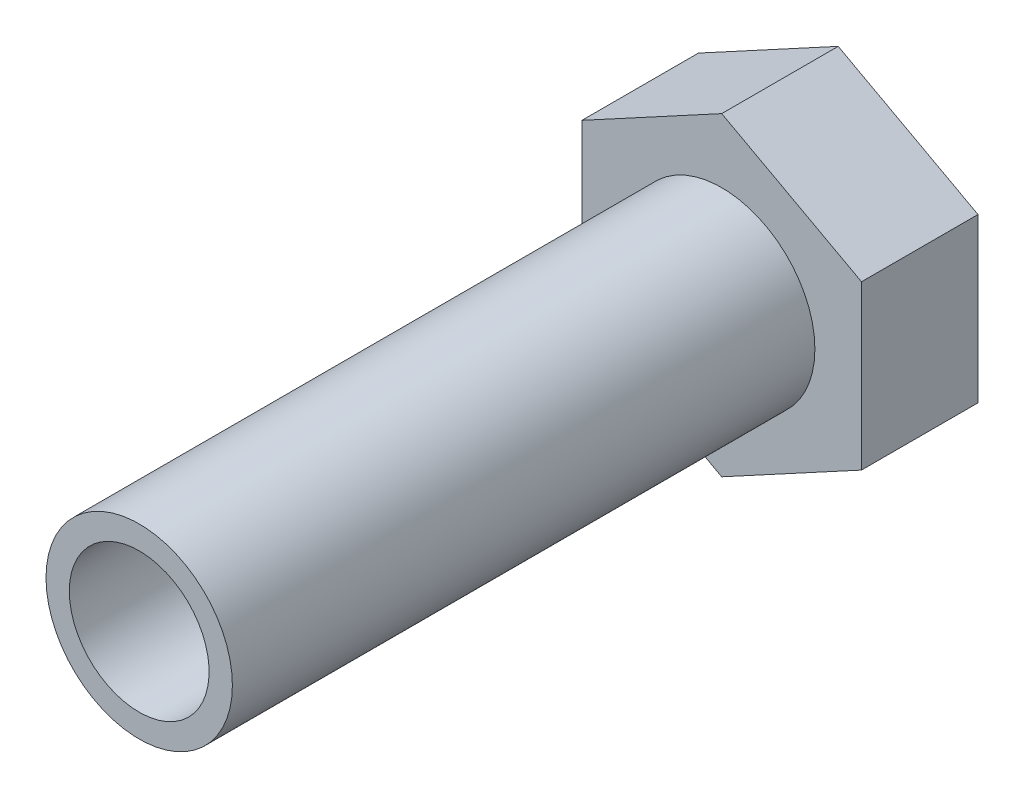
SolidWorks part; units mm, degrees
ref_plane "Plan de face" through (0, 0, 0) normal (0, 0, 1) x (1, 0, 0)
ref_plane "Plan de dessus" through (0, 0, 0) normal (0, 1, 0) x (1, 0, 0)
ref_plane "Plan de droite" through (0, 0, 0) normal (1, 0, 0) x (0, 0, -1)
sketch "Esquisse1" plane through (0, 0, 0) normal (0, 0, 1) x (1, 0, 0)
  line L0 (-33.9683, 21.2427) -> (-33.9683, -5.7573) construction
  line L1 (-33.9683, 7.7427) -> (-21.9683, 7.7427) construction
  line L2 (-33.9683, 7.7427) -> (-45.9683, 7.7427) construction
  line L3 (-45.9683, 0.7427) -> (-45.9683, 14.7427)
  line L4 (-21.9683, 0.7427) -> (-21.9683, 14.7427)
  line L5 (-45.9683, 14.7427) -> (-33.9683, 21.2427)
  line L6 (-21.9683, 14.7427) -> (-33.9683, 21.2427)
  line L7 (-21.9683, 0.7427) -> (-33.9683, -5.7573)
  line L8 (-33.9683, -5.7573) -> (-45.9683, 0.7427)
  dimension "D1" = 27
  dimension "D2" = 12
  dimension "D3" = 12
  dimension "D4" = 7
  dimension "D5" = 7
extrude "Extrusion2" add sketch "Esquisse1" along normal blind 10
sketch "Esquisse2" plane through (0, 0, 10) normal (0, 0, 1) x (1, 0, 0)
  circle A0 centre (-33.9683, 7.7427) radius 8
  dimension "D1" = 16
extrude "Extrusion3" add sketch "Esquisse2" along normal blind 50
sketch "Esquisse3" plane through (0, 0, 0) normal (0, 0, -1) x (-1, 0, 0)
  circle A0 centre (33.9683, 7.7427) radius 6
  dimension "D1" = 12
extrude "Enlèv. mat.-Extru.1" cut sketch "Esquisse3" against normal through all
